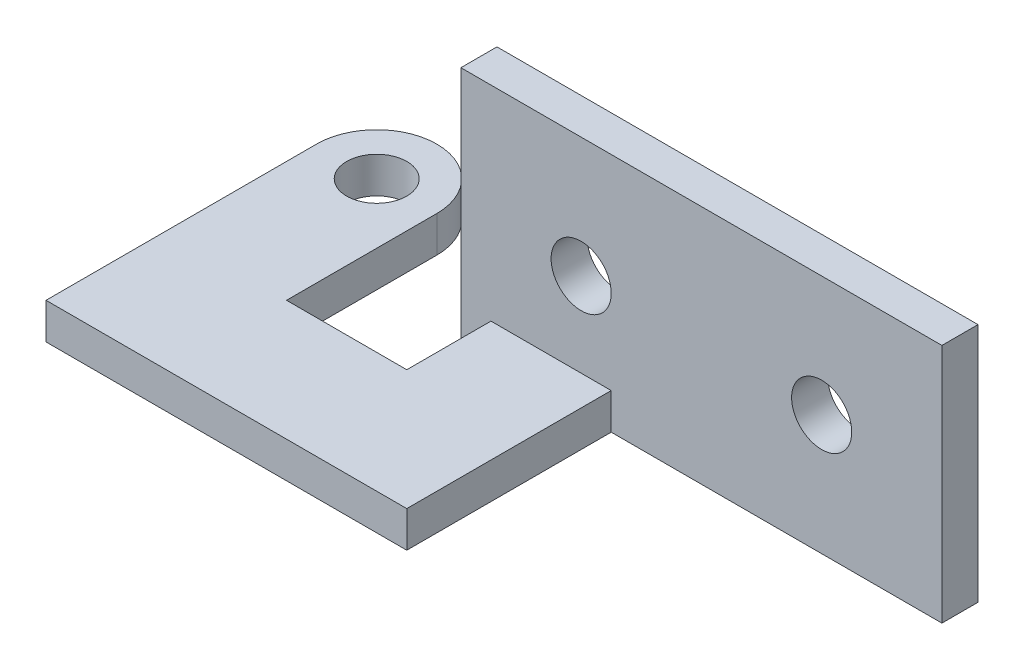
SolidWorks part; units mm, degrees
ref_plane "Ebene vorne" through (0, 0, 0) normal (0, 0, 1) x (1, 0, 0)
ref_plane "Ebene oben" through (0, 0, 0) normal (0, 1, 0) x (1, 0, 0)
ref_plane "Ebene rechts" through (0, 0, 0) normal (1, 0, 0) x (0, 0, -1)
sketch "Skizze1" plane through (0, 0, 0) normal (0, 0, 1) x (1, 0, 0)
  line L1 (0, 0) -> (40, 0)
  line L2 (0, 0) -> (0, 20)
  line L3 (0, 20) -> (40, 20)
  line L4 (40, 0) -> (40, 20)
  circle A0 centre (10, 10) radius 2.5
  circle A1 centre (30, 10) radius 2.5
  dimension "D7" = 5
  dimension "D8" = 5
  dimension "D1" = 40
  dimension "D2" = 20
  dimension "D3" = 10
  dimension "D4" = 10
  dimension "D5" = 20
  dimension "D6" = 10
extrude "Aufsatz-Linear austragen1" add sketch "Skizze1" along normal blind 3
sketch "Skizze2" plane through (0, 0, 0) normal (0, -1, 0) x (1, 0, 0)
  line L2 (-7.5, -7.5) -> (-17.5, -7.5)
  line L3 (-17.5, -7.5) -> (-17.5, 20)
  line L4 (-17.5, 20) -> (12.5, 20)
  line L6 (12.5, 20) -> (12.5, 0)
  line L7 (-7, 0) -> (197, 0) construction
  line L8 (12.5, 0) -> (2.5, 0)
  line L9 (0, 0) -> (40, 0) construction
  line L10 (2.5, 0) -> (2.5, 10)
  line L11 (2.5, 10) -> (-7.5, 10)
  line L12 (-7.5, 10) -> (-7.5, -7.5)
  circle A0 centre (-12.5, -2.5) radius 2.5
  dimension "D5" = 5
  dimension "D1" = 2.5
  dimension "D2" = 10
  dimension "D3" = 5
  dimension "D4" = 30
  dimension "D6" = 10
  dimension "D7" = 10
  dimension "D8" = 20
  dimension "D9" = 27.5
  dimension "D10" = 22.5
extrude "Aufsatz-Linear austragen2" add sketch "Skizze2" against normal blind 3
fillet "Verrundung2" radius 5 2 edges at (-7.5, 1.5, -7.5) (-17.5, 1.5, -7.5)
